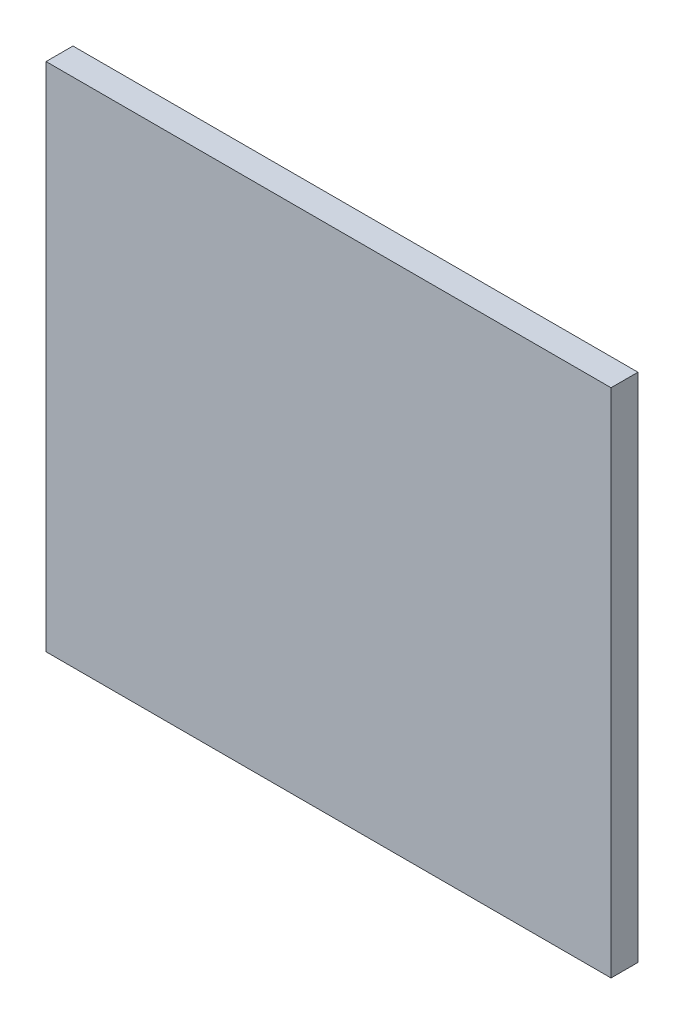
SolidWorks part; units mm, degrees
ref_plane "Plan de face" through (0, 0, 0) normal (0, 0, 1) x (1, 0, 0)
ref_plane "Plan de dessus" through (0, 0, 0) normal (0, 1, 0) x (1, 0, 0)
ref_plane "Plan de droite" through (0, 0, 0) normal (1, 0, 0) x (0, 0, -1)
sketch "Esquisse1" plane through (0, 0, 0) normal (0, 0, 1) x (1, 0, 0)
  line L1 (-50, 40) -> (76, 40)
  line L2 (-50, 40) -> (-50, -74)
  line L3 (-50, -74) -> (76, -74)
  line L4 (76, 40) -> (76, -74)
  dimension "D1" = 126
  dimension "D2" = 114
extrude "Extrusion1" add sketch "Esquisse1" along normal blind 6
